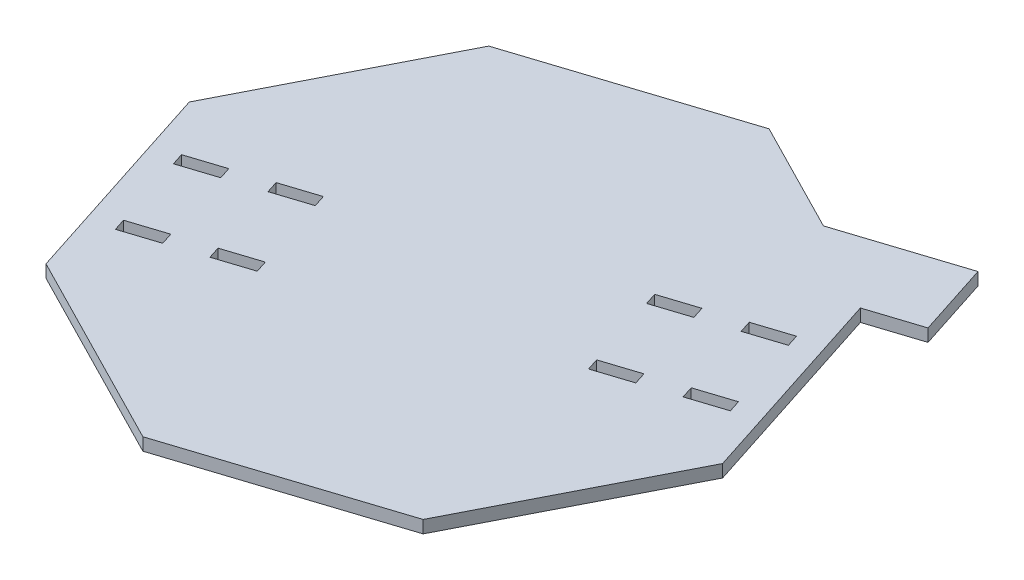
SolidWorks part; units mm, degrees
ref_plane "Front Plane" through (0, 0, 0) normal (0, 0, 1) x (1, 0, 0)
ref_plane "Top Plane" through (0, 0, 0) normal (0, 1, 0) x (1, 0, 0)
ref_plane "Right Plane" through (0, 0, 0) normal (1, 0, 0) x (0, 0, -1)
sketch "Sketch1" plane through (0, 0, 0) normal (0, 1, 0) x (1, 0, 0)
  line L1 (9.8747, 123.3227) -> (-80.2199, 94.1848)
  line L2 (-80.2199, 94.1848) -> (-123.3227, 9.8747)
  line L3 (-123.3227, 9.8747) -> (-94.1848, -80.2199)
  line L4 (-94.1848, -80.2199) -> (-9.8747, -123.3227)
  line L5 (-9.8747, -123.3227) -> (80.2199, -94.1848)
  line L6 (80.2199, -94.1848) -> (123.3227, -9.8747)
  line L7 (123.3227, -9.8747) -> (94.1848, 80.2199)
  line L8 (94.1848, 80.2199) -> (9.8747, 123.3227)
  circle A0 centre (0, 0) radius 114.3 construction
extrude "Boss-Extrude1" add sketch "Sketch1" along normal mid plane 5.334
sketch "Sketch3" plane through (0, 2.667, 0) normal (0, 1, 0) x (1, 0, 0)
  line L0 (95.3101, 76.7403) -> (117.0609, 83.7748)
  line L2 (123.3227, -9.8747) -> (94.1848, 80.2199) construction
  line L3 (117.0609, 83.7748) -> (106.8999, 115.1926)
  line L5 (106.8999, 115.1926) -> (57.211, 99.1224)
  line L6 (94.1848, 80.2199) -> (9.8747, 123.3227) construction
  line L15 (94.1848, 80.2199) -> (9.8747, 123.3227)
  line L16 (9.8747, 123.3227) -> (-80.2199, 94.1848)
  line L17 (-80.2199, 94.1848) -> (-123.3227, 9.8747)
  line L18 (-123.3227, 9.8747) -> (-94.1848, -80.2199)
  line L19 (-94.1848, -80.2199) -> (-9.8747, -123.3227)
  line L20 (-9.8747, -123.3227) -> (80.2199, -94.1848)
  line L21 (80.2199, -94.1848) -> (123.3227, -9.8747)
  line L22 (123.3227, -9.8747) -> (94.1848, 80.2199)
  line L23 (94.1848, 80.2199) -> (57.211, 99.1224)
  line L30 (95.3101, 76.7403) -> (94.1848, 80.2199)
  dimension "D1" = 22.86
  dimension "D2" = 33.02
  dimension "D3" = 0
extrude "Boss-Extrude2" add sketch "Sketch3" against normal blind 5.334
other "Cavity2"
other "motorMountSide<4>@Platform2"
other "Cavity3"
other "motorMountSide<2>@Platform2"
other "Cavity4"
other "motorMountSide<3>@Platform2"
other "motorMountSide<1>@Platform2"
equation "\"D1@Boss-Extrude1\"=\"material\""
equation "\"baseLength\"=9"
equation "\"material\"=\"MDF@Platform.assembly\""
equation "\"D1@Boss-Extrude2\"=\"material\""
